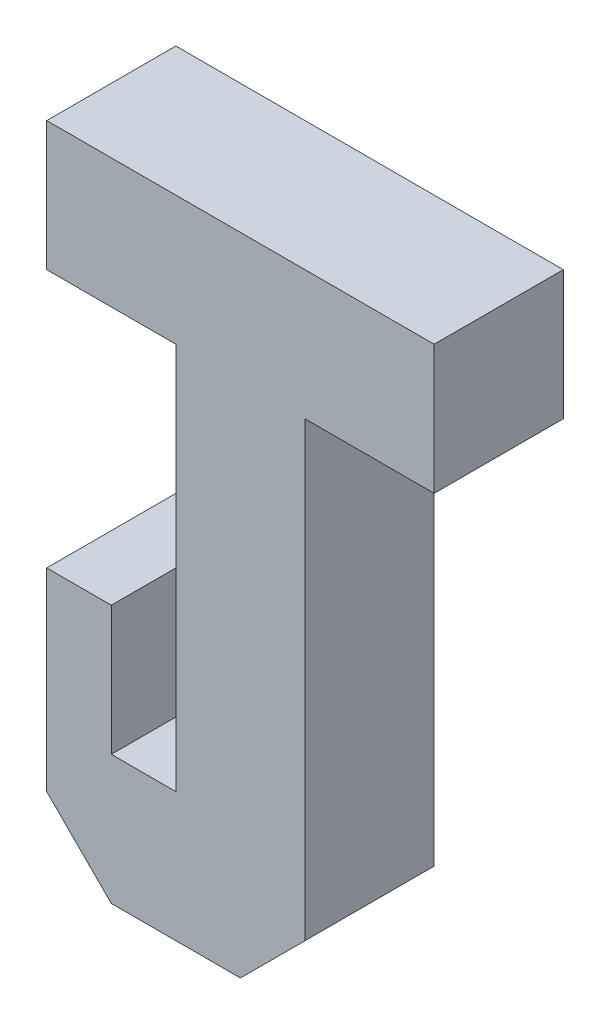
SolidWorks part; units mm, degrees
ref_plane "Plan de face" through (0, 0, 0) normal (0, 0, 1) x (1, 0, 0)
ref_plane "Plan de dessus" through (0, 0, 0) normal (0, 1, 0) x (1, 0, 0)
ref_plane "Plan de droite" through (0, 0, 0) normal (1, 0, 0) x (0, 0, -1)
sketch "Esquisse1" plane through (0, 0, 0) normal (0, 0, 1) x (1, 0, 0)
  line L0 (10, 40) -> (20, 40)
  line L1 (-10, 50) -> (20, 50)
  line L2 (-10, 50) -> (-10, 40)
  line L3 (-10, 40) -> (0, 40)
  line L4 (20, 50) -> (20, 40)
  line L6 (0, 40) -> (0, 10)
  line L7 (0, 0) -> (10, 0)
  line L8 (10, 40) -> (10, 0)
  line L9 (0, 0) -> (-10, 0)
  line L11 (0, 10) -> (-5, 10)
  line L12 (-10, 0) -> (-10, 10)
  line L14 (-10, 10) -> (-10, 20)
  line L15 (-10, 20) -> (-5, 20)
  line L16 (-5, 10) -> (-5, 20)
  dimension "D1" = 30
  dimension "D2" = 10
  dimension "D3" = 50
  dimension "D4" = 10
  dimension "D5" = 10
  dimension "D6" = 10
  dimension "D7" = 5
  dimension "D8" = 10
  dimension "D9" = 10
  dimension "D10" = 5
  dimension "D11" = 10
extrude "Boss.-Extru.1" add sketch "Esquisse1" along normal blind 10
chamfer "Chanfrein1" distance 5 angle 45 2 edges at (10, 0, 5) (-10, 0, 5)
